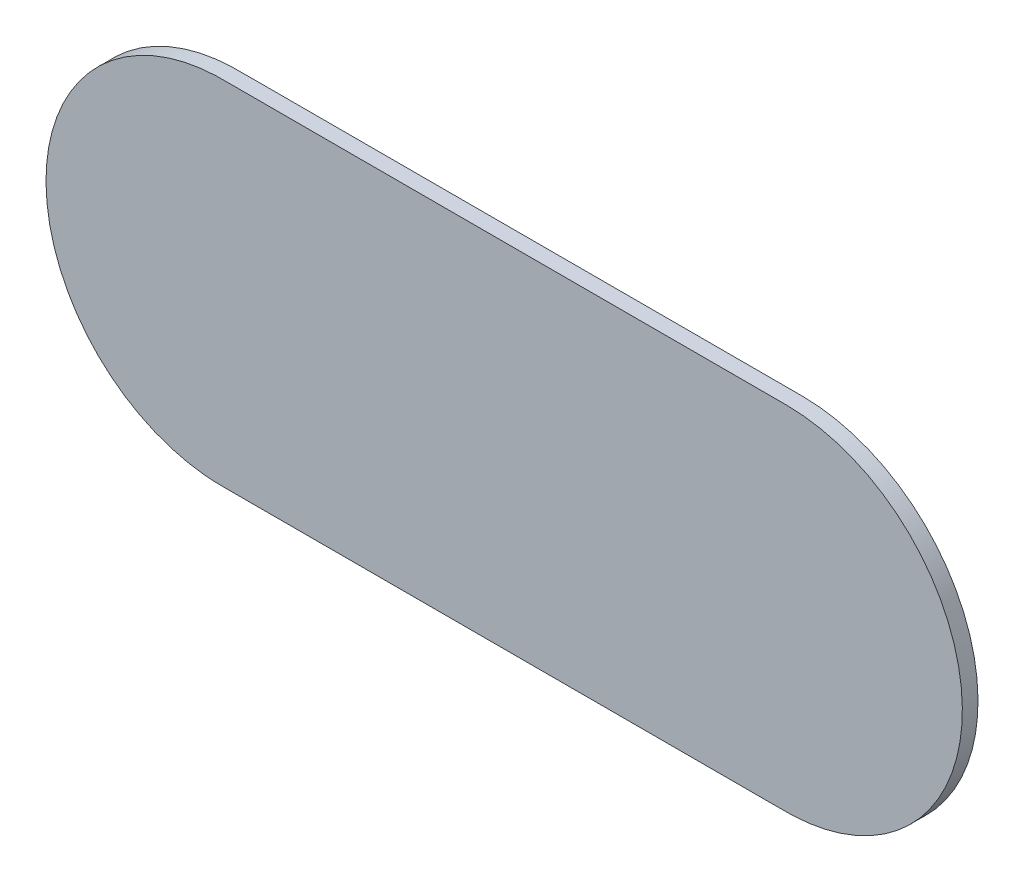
SolidWorks part; units mm, degrees
ref_plane "Plane1" through (0, 0, 0) normal (0, 0, 1) x (1, 0, 0)
ref_plane "Plane2" through (0, 0, 0) normal (0, 1, 0) x (1, 0, 0)
ref_plane "Plane3" through (0, 0, 0) normal (1, 0, 0) x (0, 0, -1)
sketch "Sketch1" plane through (0, 0, 0) normal (0, 0, 1) x (1, 0, 0)
  line L6 (457.2, 152.4) -> (0, 152.4)
  line L7 (0, -152.4) -> (457.2, -152.4)
  arc A6 (0, 152.4) -> (0, -152.4) centre (0, 0) ccw
  arc A7 (457.2, -152.4) -> (457.2, 152.4) centre (457.2, 0) ccw
extrude "Base-Extrude" add sketch "Sketch1" against normal blind 12.7
sketch "Sketch2" plane through (0, 0, 0) normal (0, 0, 1) x (1, 0, 0)
  line L2 (457.2, 142.875) -> (0, 142.875)
  line L3 (457.2, 142.875) -> (0, 142.875) construction
  line L4 (0, -142.875) -> (457.2, -142.875)
  line L5 (0, -142.875) -> (457.2, -142.875) construction
  arc A2 (457.2, -142.875) -> (457.2, 142.875) centre (457.2, 0) ccw
  arc A3 (457.2, -142.875) -> (457.2, 142.875) centre (457.2, 0) ccw construction
  arc A4 (0, 142.875) -> (0, -142.875) centre (0, 0) ccw
  arc A5 (0, 142.875) -> (0, -142.875) centre (0, 0) ccw construction
  spline S0 degree 3 poles (0.66, -142.875) (152.62, -142.875) (304.58, -142.875) (456.54, -142.875) (456.6133, -142.875) (456.76, -142.875) (456.98, -142.875) (457.1267, -142.875) (457.2, -142.875) (457.272, -142.875) (457.416, -142.875) (457.632, -142.8744) (457.7759, -142.8739) (457.8479, -142.8735) (741.0237, -141.5893) (741.0237, 141.5893) (457.8479, 142.8735) (457.7759, 142.8739) (457.632, 142.8744) (457.416, 142.875) (457.272, 142.875) (457.2, 142.875) (457.1267, 142.875) (456.98, 142.875) (456.76, 142.875) (456.6133, 142.875) (456.54, 142.875) (304.58, 142.875) (152.62, 142.875) (0.66, 142.875) (0.5867, 142.875) (0.44, 142.875) (0.22, 142.875) (0.0733, 142.875) (0, 142.875) (-0.072, 142.875) (-0.216, 142.875) (-0.432, 142.8744) (-0.5759, 142.8739) (-0.6479, 142.8735) (-283.8237, 141.5893) (-283.8237, -141.5893) (-0.6479, -142.8735) (-0.5759, -142.8739) (-0.432, -142.8744) (-0.216, -142.875) (-0.072, -142.875) (0, -142.875) (0.0733, -142.875) (0.22, -142.875) (0.44, -142.875) (0.5867, -142.875) (0.66, -142.875) (152.62, -142.875) (304.58, -142.875) knots -0.000148 0 0 0 0.306271 0.306271 0.306271 0.306419 0.306567 0.306714 0.306714 0.306714 0.306859 0.307005 0.30715 0.30715 0.30715 0.499121 0.499121 0.499121 0.499266 0.499412 0.499557 0.499557 0.499557 0.499704 0.499852 0.5 0.5 0.5 0.806271 0.806271 0.806271 0.806419 0.806567 0.806714 0.806714 0.806714 0.806859 0.807005 0.80715 0.80715 0.80715 0.999121 0.999121 0.999121 0.999266 0.999412 0.999557 0.999557 0.999557 0.999704 0.999852 1 1 1 1.306271 1.306271 1.306271 weights 1 1 1 1 1 1 1 1 1 1 1 1 1 1 0.336357 0.336357 1 1 1 1 1 1 1 1 1 1 1 1 1 1 1 1 1 1 1 1 1 1 1 1 0.336357 0.336357 1 1 1 1 1 1 1 1 1 1 1 1 1 only from (0.66, -142.875) to (0.66, -142.875)
  dimension "D1" = 9.525
extrude "Cut-Extrude4" cut sketch "Sketch2" along normal blind 2.54 and the other way through all flip side to cut
